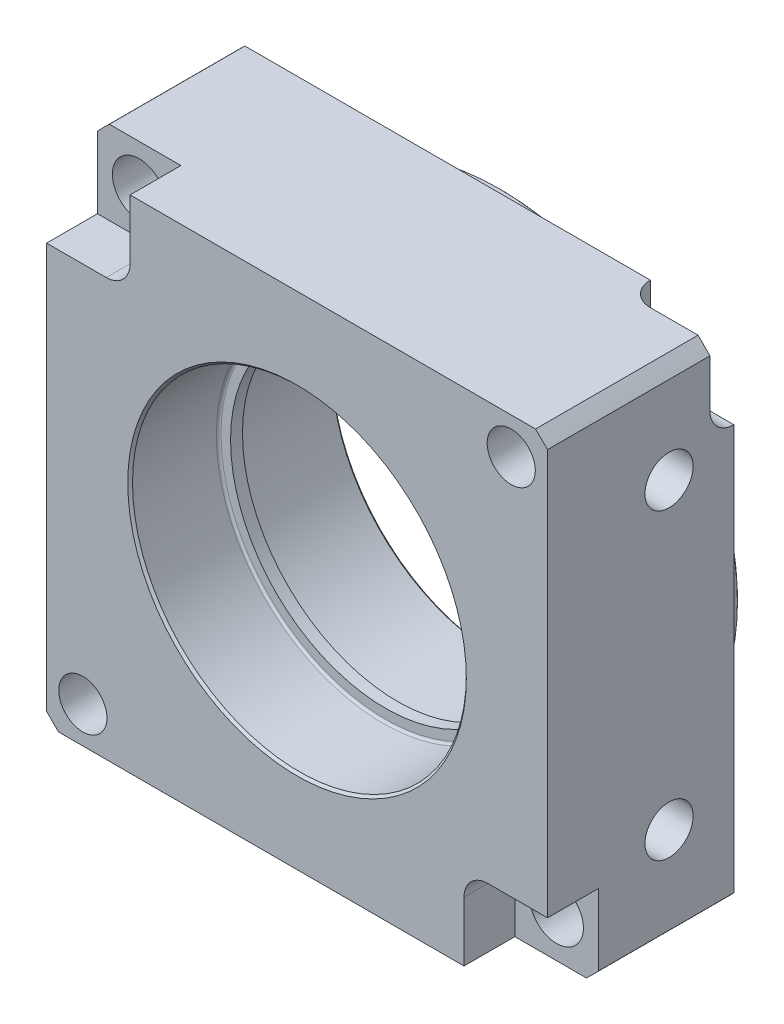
SolidWorks part; units mm, degrees
other "<217-2625-002 Rev1>-<Imported1>"
ref_plane "Front Plane" through (0, 0, 0) normal (0, 0, 1) x (1, 0, 0)
ref_plane "Top Plane" through (0, 0, 0) normal (0, 1, 0) x (1, 0, 0)
ref_plane "Right Plane" through (0, 0, 0) normal (1, 0, 0) x (0, 0, -1)
mirrored part "217-2625-002 Rev1_Mirrored"
